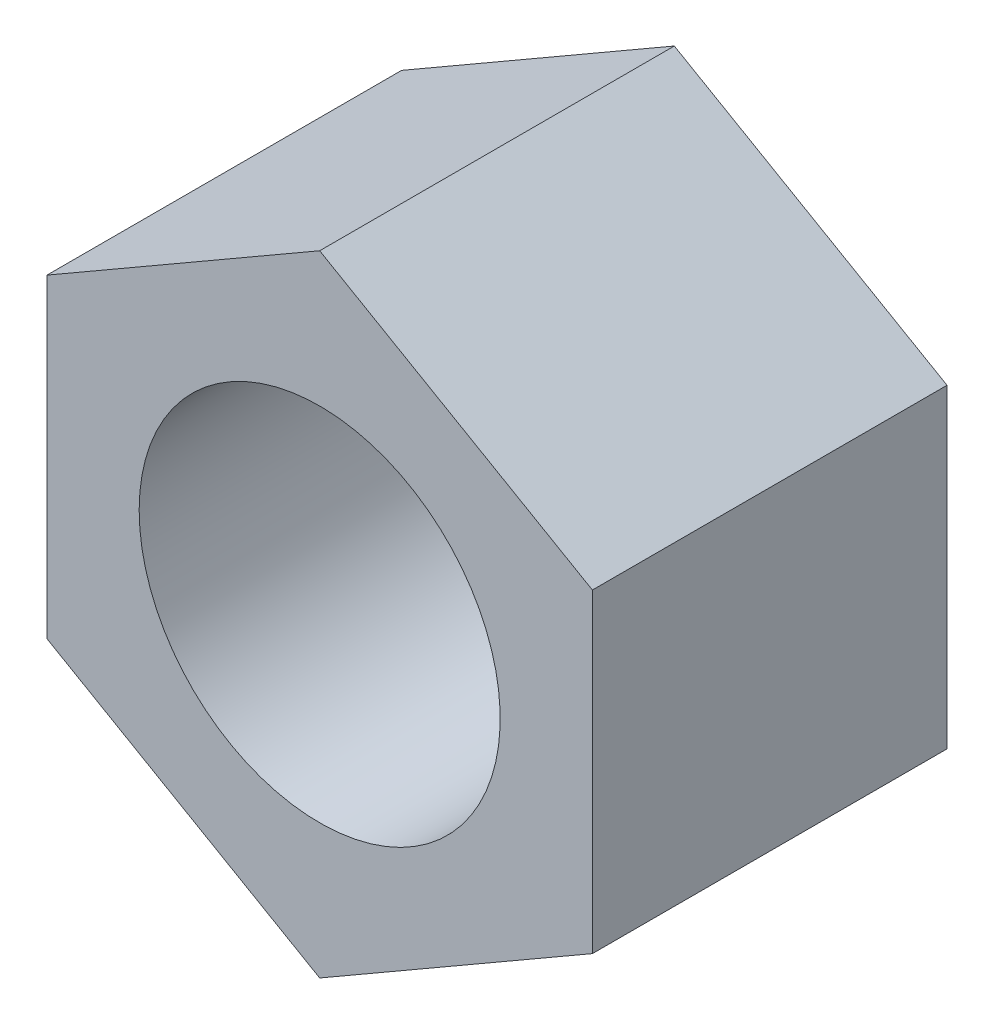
SolidWorks part; units mm, degrees
ref_plane "Front Plane" through (0, 0, 0) normal (1, 0, 0) x (0, 1, 0)
ref_plane "Top Plane" through (0, 0, 0) normal (0, 0, 1) x (0, 1, 0)
ref_plane "Right Plane" through (0, 0, 0) normal (0, 1, 0) x (-1, 0, 0)
sketch "Sketch1" plane through (0, 0, 0) normal (0, 0, 1) x (0, 1, 0)
  line L1 (38.7698, -67.1513) -> (77.5396, 0)
  line L2 (77.5396, 0) -> (38.7698, 67.1513)
  line L3 (38.7698, 67.1513) -> (-38.7698, 67.1513)
  line L4 (-38.7698, 67.1513) -> (-77.5396, 0)
  line L5 (-77.5396, 0) -> (-38.7698, -67.1513)
  line L6 (-38.7698, -67.1513) -> (38.7698, -67.1513)
  circle A0 centre (0, 0) radius 44.45
  circle A1 centre (0, 0) radius 67.1512 construction
  dimension "D1" = 88.9
  dimension "D2" = 134.3025
extrude "Nut body" add sketch "Sketch1" along normal blind 87.3252
